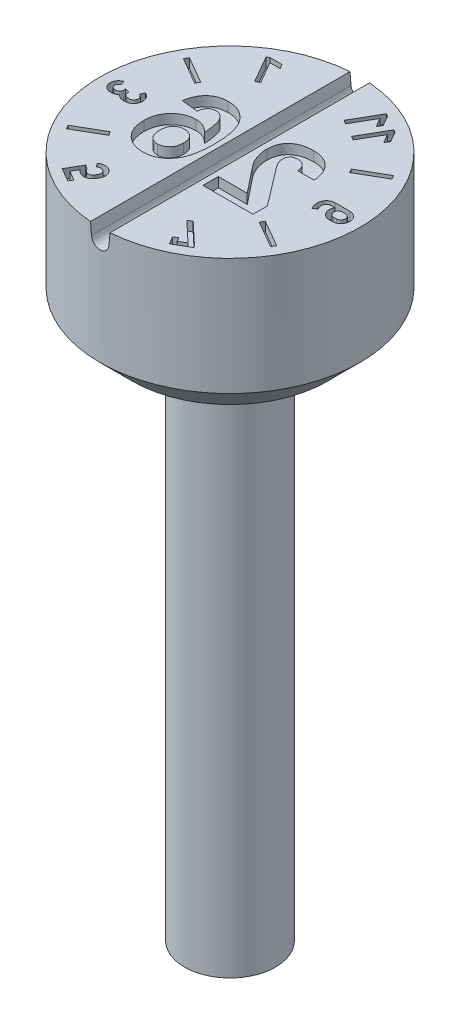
SolidWorks part; units mm, degrees
ref_plane "Front Plane" through (0, 0, 0) normal (0, 0, 1) x (1, 0, 0)
ref_plane "Top Plane" through (0, 0, 0) normal (0, 1, 0) x (1, 0, 0)
ref_plane "Right Plane" through (0, 0, 0) normal (1, 0, 0) x (0, 0, -1)
imported_body "Imported1"
sketch "Sketch1" plane through (0, -0.15, 0) normal (0, 1, 0) x (1, 0, 0)
  line L2 (-0.271, -0.2942) -> (-0.271, 0.2969)
  line L3 (-1.0488, 0.2969) -> (-1.0488, -0.2942)
  line L4 (-0.271, -0.2942) -> (-0.271, 0.2969)
  line L5 (-1.0488, 0.2969) -> (-1.0488, -0.2942)
  spline S4 degree 3 poles (2994.4705, 176.8411) (-18.9836, -5.3744) (0.0034, -1.9139) (-0.2768, 0.3791) (-0.2843, 0.4171) (-0.2952, 0.4525) (-0.3092, 0.4856) (-0.3265, 0.5161) (-0.3468, 0.5442) (-0.3702, 0.5697) (-0.3965, 0.5927) (-0.4259, 0.6123) (-0.4582, 0.629) (-0.4931, 0.6429) (-0.5308, 0.6534) (-0.5714, 0.6607) (-3.1291, 0.9309) (-6.6572, -17.4741) (149.6947, 2996.7881) knots -11.12639 -11.12639 -11.12639 -11.12639 0.06986 0.136229 0.199072 0.25942 0.317893 0.375172 0.431376 0.487845 0.544707 0.602193 0.661345 0.722459 0.786428 0.853446 0.924507 13.399563 13.399563 13.399563 13.399563 only from (-0.271, 0.2969) to (-0.6599, 0.6662)
  spline S5 degree 3 poles (-151.0627, 2996.8497) (5.3528, -17.4107) (1.8179, 0.9306) (-0.7487, 0.6607) (-0.7894, 0.6534) (-0.8273, 0.6429) (-0.8621, 0.629) (-0.8943, 0.6126) (-0.9236, 0.5929) (-0.9499, 0.57) (-0.9733, 0.5445) (-0.9935, 0.5164) (-1.011, 0.4861) (-1.0246, 0.4529) (-1.0354, 0.4174) (-1.0435, 0.3795) (-1.3071, -2.0641) (16.6253, -5.3462) (-2997.9649, 133.1801) knots -12.434531 -12.434531 -12.434531 -12.434531 0.075447 0.146896 0.214298 0.278228 0.339305 0.397836 0.455287 0.512114 0.568549 0.624718 0.681585 0.739853 0.800578 0.863471 0.92975 12.839416 12.839416 12.839416 12.839416 only from (-0.6599, 0.6662) to (-1.0488, 0.2969)
  spline S6 degree 3 poles (-2995.6461, -179.6533) (17.7835, 5.3733) (-1.3244, 1.9021) (-1.043, -0.3763) (-1.0355, -0.4141) (-1.0246, -0.4496) (-1.0106, -0.4826) (-0.9933, -0.5133) (-0.9728, -0.5415) (-0.9493, -0.5671) (-0.9231, -0.59) (-0.8936, -0.6097) (-0.8615, -0.6264) (-0.8264, -0.6398) (-0.7889, -0.6509) (-0.7483, -0.658) (1.7818, -0.9301) (5.3903, 17.56) (-167.4806, -2995.8871) knots -11.059669 -11.059669 -11.059669 -11.059669 0.06988 0.135837 0.198699 0.259064 0.317554 0.374849 0.431675 0.488161 0.545039 0.602541 0.661711 0.722684 0.786373 0.853837 0.924919 13.273114 13.273114 13.273114 13.273114 only from (-1.0488, -0.2942) to (-0.6599, -0.6635)
  spline S7 degree 3 poles (141.2292, -2997.2372) (-6.6628, 17.2306) (-3.1641, -0.9253) (-0.5711, -0.6581) (-0.5304, -0.6505) (-0.4926, -0.6397) (-0.4576, -0.6258) (-0.4253, -0.6092) (-0.3959, -0.5892) (-0.3697, -0.566) (-0.3463, -0.5403) (-0.3261, -0.512) (-0.3089, -0.4815) (-0.2953, -0.4485) (-0.2843, -0.4132) (-0.2764, -0.3757) (-0.0114, 2.0143) (-17.9999, 5.3233) (2996.0538, -146.2482) knots -12.575974 -12.575974 -12.575974 -12.575974 0.075539 0.147075 0.214639 0.278766 0.339917 0.399105 0.456869 0.514052 0.570876 0.627466 0.684188 0.742528 0.802498 0.865468 0.930965 12.596589 12.596589 12.596589 12.596589 only from (-0.6599, -0.6635) to (-0.271, -0.2942)
  spline S8 degree 3 poles (-0.271, 0.2969) (-0.2713, 0.3111) (-0.2718, 0.3388) (-0.2768, 0.3791) (-0.2843, 0.4171) (-0.2952, 0.4525) (-0.3092, 0.4856) (-0.3265, 0.5161) (-0.3468, 0.5442) (-0.3702, 0.5697) (-0.3965, 0.5927) (-0.4259, 0.6123) (-0.4582, 0.629) (-0.4931, 0.6429) (-0.5308, 0.6534) (-0.5714, 0.6607) (-0.6147, 0.6653) (-0.6445, 0.6659) (-0.6599, 0.6662) knots 0 0 0 0 0.06986 0.136229 0.199072 0.25942 0.317893 0.375172 0.431376 0.487845 0.544707 0.602193 0.661345 0.722459 0.786428 0.853446 0.924507 1 1 1 1
  spline S9 degree 3 poles (-0.6599, 0.6662) (-0.6753, 0.6659) (-0.7052, 0.6653) (-0.7487, 0.6607) (-0.7894, 0.6534) (-0.8273, 0.6429) (-0.8621, 0.629) (-0.8943, 0.6126) (-0.9236, 0.5929) (-0.9499, 0.57) (-0.9733, 0.5445) (-0.9935, 0.5164) (-1.011, 0.4861) (-1.0246, 0.4529) (-1.0354, 0.4174) (-1.0435, 0.3795) (-1.0479, 0.339) (-1.0485, 0.3112) (-1.0488, 0.2969) knots 0 0 0 0 0.075447 0.146896 0.214298 0.278228 0.339305 0.397836 0.455287 0.512114 0.568549 0.624718 0.681585 0.739853 0.800578 0.863471 0.92975 1 1 1 1
  spline S10 degree 3 poles (-1.0488, -0.2942) (-1.0486, -0.3084) (-1.048, -0.3361) (-1.043, -0.3763) (-1.0355, -0.4141) (-1.0246, -0.4496) (-1.0106, -0.4826) (-0.9933, -0.5133) (-0.9728, -0.5415) (-0.9493, -0.5671) (-0.9231, -0.59) (-0.8936, -0.6097) (-0.8615, -0.6264) (-0.8264, -0.6398) (-0.7889, -0.6509) (-0.7483, -0.658) (-0.705, -0.6626) (-0.6752, -0.6632) (-0.6599, -0.6635) knots 0 0 0 0 0.06988 0.135837 0.198699 0.259064 0.317554 0.374849 0.431675 0.488161 0.545039 0.602541 0.661711 0.722684 0.786373 0.853837 0.924919 1 1 1 1
  spline S11 degree 3 poles (-0.6599, -0.6635) (-0.6445, -0.6632) (-0.6146, -0.6626) (-0.5711, -0.6581) (-0.5304, -0.6505) (-0.4926, -0.6397) (-0.4576, -0.6258) (-0.4253, -0.6092) (-0.3959, -0.5892) (-0.3697, -0.566) (-0.3463, -0.5403) (-0.3261, -0.512) (-0.3089, -0.4815) (-0.2953, -0.4485) (-0.2843, -0.4132) (-0.2764, -0.3757) (-0.2719, -0.3356) (-0.2713, -0.3083) (-0.271, -0.2942) knots 0 0 0 0 0.075539 0.147075 0.214639 0.278766 0.339917 0.399105 0.456869 0.514052 0.570876 0.627466 0.684188 0.742528 0.802498 0.865468 0.930965 1 1 1 1
  dimension "D1" = 0
extrude "Boss-Extrude1" add sketch "Sketch1" along normal up to surface (0.15 mm away)
sketch "Sketch2" plane through (0, 0, 0) normal (0, 1, 0) x (1, 0, 0)
  line L0 (0.2345, -0.65) -> (1.0033, -0.65) construction
  text T0 "6" font "Arial" height 1.3132
extrude "Cut-Extrude1" cut sketch "Sketch2" against normal up to surface (0.15 mm away)
